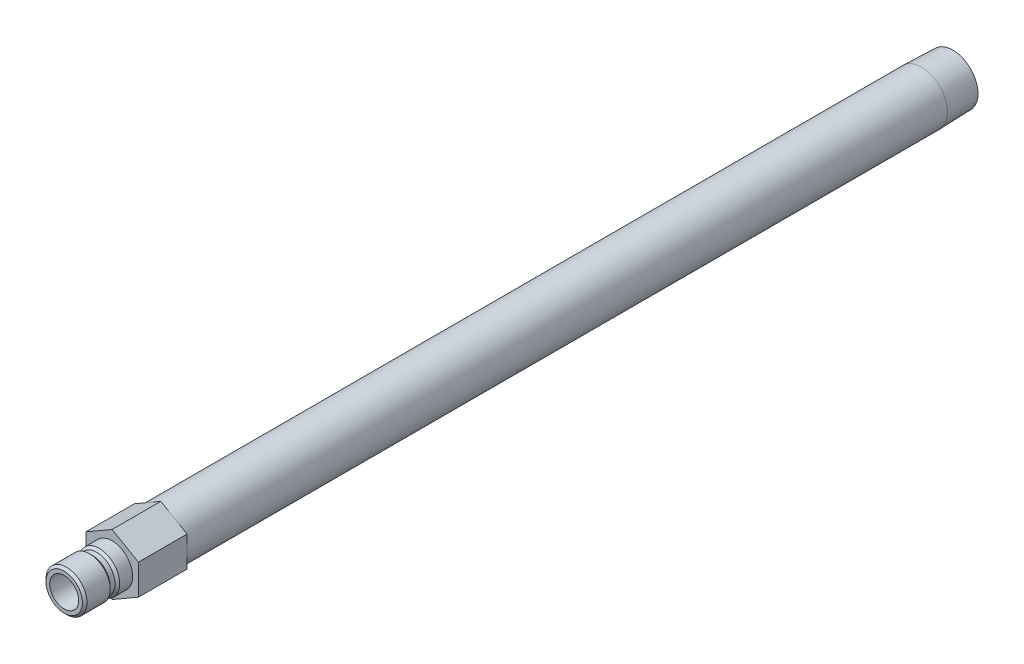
SolidWorks part; units mm, degrees
ref_plane "Front Plane" through (0, 0, 0) normal (0, 0, 1) x (1, 0, 0)
ref_plane "Top Plane" through (0, 0, 0) normal (0, 1, 0) x (1, 0, 0)
ref_plane "Right Plane" through (0, 0, 0) normal (1, 0, 0) x (0, 0, -1)
sketch "Sketch1" plane through (0, 0, 0) normal (1, 0, 0) x (0, 0, -1)
  line L0 (0, 0) -> (-18.923, 0) construction
  line L1 (-15.748, 4.7625) -> (-15.748, 5.9817)
  line L2 (-6.604, 5.9817) -> (-6.604, 0) construction
  line L3 (-14.986, 6.7437) -> (-7.366, 6.7437)
  line L4 (0, 8.5725) -> (0, 0) construction
  line L5 (-6.604, 5.9817) -> (-5.0165, 5.9817)
  line L6 (-4.2545, 6.7437) -> (0, 6.7437)
  line L7 (0, 6.7437) -> (0, 8.5725)
  line L8 (-6.604, 5.9817) -> (-7.366, 6.7437)
  line L9 (-5.0165, 5.9817) -> (-4.2545, 6.7437)
  line L10 (-15.748, 5.9817) -> (-14.986, 6.7437)
  line L11 (-15.748, 4.7625) -> (16.002, 4.7625)
  line L12 (0, 8.5725) -> (266.0142, 8.5725)
  line L13 (266.0142, 8.5725) -> (276.352, 8.2494)
  line L14 (276.352, 8.2494) -> (276.352, 6.2611)
  line L15 (0, 6.7437) -> (16.002, 6.7437) construction
  line L16 (16.002, 6.7437) -> (16.002, 0) construction
  line L17 (16.002, 0) -> (0, 0) construction
  line L18 (16.002, 4.7625) -> (16.002, 6.2611)
  line L19 (16.002, 6.2611) -> (276.352, 6.2611)
  dimension "D1" = 15.748
  dimension "D2" = 1.5875
  dimension "D3" = 0.762
  dimension "D4" = 45
  dimension "D5" = 9.144
  dimension "D6" = 45
  dimension "D7" = 1.79
  dimension "D8" = 10.3378
  dimension "D9" = 292.1
  dimension "D10" = 3.175
  dimension "D11" = 9.525
  dimension "D12" = 17.145
  dimension "D13" = 31.75
  dimension "D14" = 13.4874
  dimension "D15" = 12.5222
revolve "Revolve1" add sketch "Sketch1" angle 360 about L0
sketch "Sketch2" plane through (0, 0, 0) normal (0, 0, 1) x (1, 0, 0)
  line L1 (-8.636, 4.986) -> (-8.636, -4.986)
  line L2 (-8.636, -4.986) -> (0, -9.972)
  line L3 (0, -9.972) -> (8.636, -4.986)
  line L4 (8.636, -4.986) -> (8.636, 4.986)
  line L5 (8.636, 4.986) -> (0, 9.972)
  line L6 (0, 9.972) -> (-8.636, 4.986)
  circle A0 centre (0, 0) radius 8.636 construction
  circle A1 centre (0, 0) radius 4.7625 construction
  circle A2 centre (0, 0) radius 4.7625
  dimension "D1" = 17.272
extrude "Boss-Extrude1" add sketch "Sketch2" against normal up to vertex (16.002 mm away) from vertex at 0
